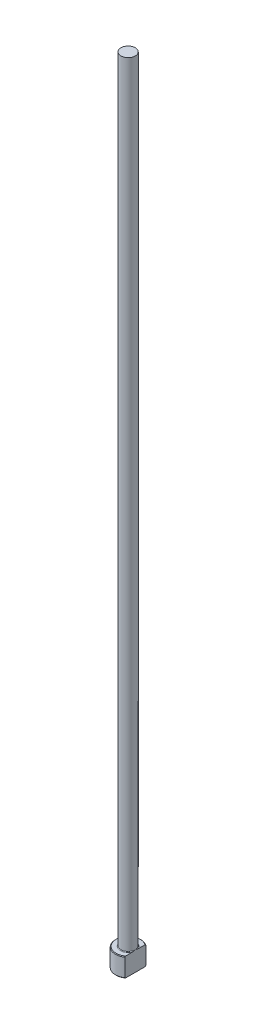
SolidWorks part; units mm, degrees
ref_plane "Front Plane" through (0, 0, 0) normal (0, 0, 1) x (1, 0, 0)
ref_plane "Top Plane" through (0, 0, 0) normal (0, 1, 0) x (1, 0, 0)
ref_plane "Right Plane" through (0, 0, 0) normal (1, 0, 0) x (0, 0, -1)
sketch "Sketch1" plane through (0, 0, 0) normal (0, 0, 1) x (1, 0, 0)
  line L0 (0, 259.9588) -> (0, -15.1925) construction
  line L1 (0, 0) -> (-4, 0)
  line L2 (-4, 0) -> (-4, 6)
  line L3 (-4, 6) -> (-2.25, 6)
  line L4 (-2.25, 6) -> (-2.25, 250)
  line L5 (-2.25, 250) -> (0, 250)
  line L6 (0, 250) -> (0, 0)
  dimension "L" = 250
  dimension "H" = 8
  dimension "T" = 6
  dimension "D" = 4.5
revolve "Revolve1" add sketch "Sketch1" angle 360 about L0
chamfer "Chamfer1" distance 0.2 angle 45 2 edges at (0, 6, 4) (0, 0, 4)
fillet "Fillet1" radius 0.2 1 edges at (0, 6, 2.25)
sketch "Sketch2" plane through (0, 0, 0) normal (0, 1, 0) x (1, 0, 0)
  line L0 (2.25, -3.3072) -> (2.25, 3.3072)
  circle A0 centre (0, 0) radius 4 construction
  arc A1 (2.25, -3.3072) -> (2.25, 3.3072) centre (0, 0) ccw
  circle A2 centre (0, 0) radius 2.25 construction
extrude "KEYED HEAD" cut sketch "Sketch2" along normal through all
